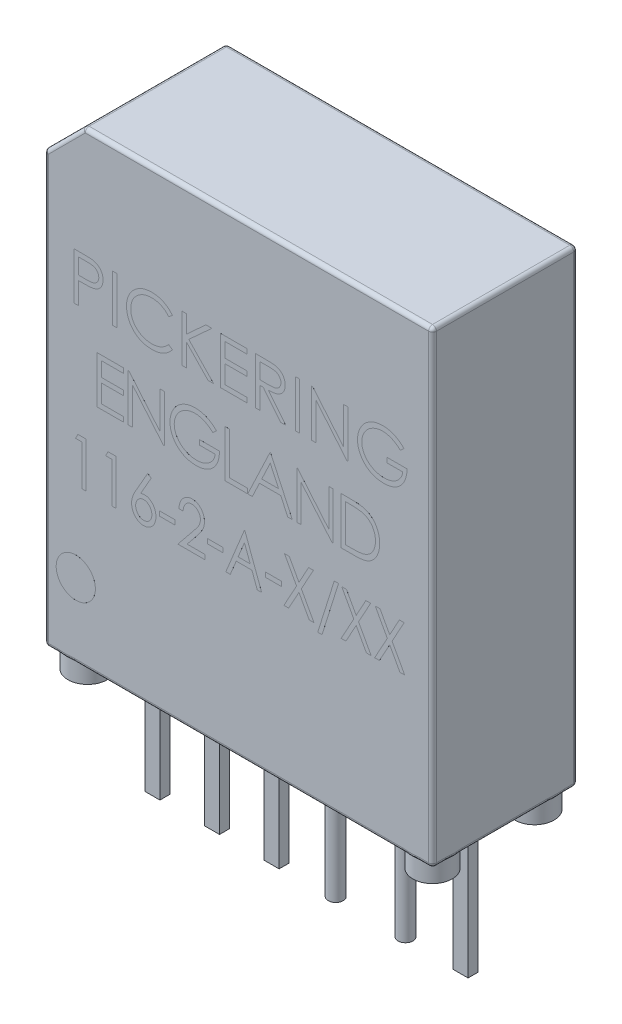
SolidWorks part; units mm, degrees
ref_plane "Front Plane" through (0, 0, 0) normal (0, 0, 1) x (1, 0, 0)
ref_plane "Top Plane" through (0, 0, 0) normal (0, 1, 0) x (1, 0, 0)
ref_plane "Right Plane" through (0, 0, 0) normal (1, 0, 0) x (0, 0, -1)
sketch "Sketch1" plane through (0, 0, 0) normal (0, 1, 0) x (1, 0, 0)
  line L1 (4.95, -1.85) -> (-4.95, -1.85)
  line L2 (4.95, -1.85) -> (4.95, 1.85)
  line L3 (4.95, 1.85) -> (-4.95, 1.85)
  line L4 (-4.95, -1.85) -> (-4.95, 1.85)
  line L5 (4.95, -1.85) -> (-4.95, 1.85) construction
  line L6 (4.95, 1.85) -> (-4.95, -1.85) construction
  point P0 (0, 0)
  dimension "D1" = 3.7
  dimension "D2" = 9.9
extrude "Main body" add sketch "Sketch1" along normal blind 11.942
sketch "Sketch2" plane through (0, 0, 1.85) normal (0, 0, 1) x (1, 0, 0)
  line L0 (-3.95, 11.942) -> (-4.95, 10.942)
  line L1 (-4.95, 11.942) -> (4.95, 11.942) construction
  line L2 (-4.95, 11.942) -> (-4.95, 0) construction
  line L3 (-4.95, 10.942) -> (-4.95, 11.942)
  line L4 (-4.95, 11.942) -> (-3.95, 11.942)
  dimension "D1" = 45
  dimension "D2" = 8.9
extrude "Box style cut" cut sketch "Sketch2" against normal through all
sketch "Sketch3" plane through (0, 0, 0) normal (0, -1, 0) x (1, 0, 0)
  line L0 (-4.95, 1.85) -> (4.95, 1.85) construction
  line L1 (-4.95, -1.85) -> (-4.95, 1.85) construction
  line L2 (4.95, -1.85) -> (-4.95, -1.85) construction
  line L3 (4.95, 1.85) -> (4.95, -1.85) construction
  circle A0 centre (-4.4, 1.3) radius 0.5
  circle A1 centre (-4.4, -1.3) radius 0.5
  circle A2 centre (4.4, -1.3) radius 0.5
  circle A3 centre (4.4, 1.3) radius 0.5
  dimension "D1" = 1
  dimension "D4" = 1
  dimension "D7" = 1
  dimension "D9" = 1
  dimension "D2" = 0.55
  dimension "D3" = 0.55
  dimension "D5" = 0.55
  dimension "D6" = 0.55
  dimension "D8" = 0.55
  dimension "D10" = 0.55
  dimension "D11" = 0.55
  dimension "D12" = 0.55
extrude "Feet" add sketch "Sketch3" along normal blind 0.508
sketch "Sketch4" plane through (0, 0, 0) normal (0, -1, 0) x (1, 0, 0)
  line L1 (-3.7395, -0.14) -> (-4.1205, -0.14)
  line L2 (-3.7395, -0.14) -> (-3.7395, 0.114)
  line L3 (-3.7395, 0.114) -> (-4.1205, 0.114)
  line L4 (-4.1205, -0.14) -> (-4.1205, 0.114)
  line L5 (-3.7395, -0.14) -> (-4.1205, 0.114) construction
  line L6 (-3.7395, 0.114) -> (-4.1205, -0.14) construction
  line L7 (-2.2195, -0.14) -> (-2.6005, -0.14)
  line L8 (-2.2195, -0.14) -> (-2.2195, 0.114)
  line L9 (-2.2195, 0.114) -> (-2.6005, 0.114)
  line L10 (-2.6005, -0.14) -> (-2.6005, 0.114)
  line L11 (-2.2195, -0.14) -> (-2.6005, 0.114) construction
  line L12 (-2.2195, 0.114) -> (-2.6005, -0.14) construction
  line L13 (-0.6995, -0.14) -> (-1.0805, -0.14)
  line L14 (-0.6995, -0.14) -> (-0.6995, 0.114)
  line L15 (-0.6995, 0.114) -> (-1.0805, 0.114)
  line L16 (-1.0805, -0.14) -> (-1.0805, 0.114)
  line L17 (-0.6995, -0.14) -> (-1.0805, 0.114) construction
  line L18 (-0.6995, 0.114) -> (-1.0805, -0.14) construction
  line L33 (4.1205, -0.14) -> (3.7395, -0.14)
  line L34 (4.1205, -0.14) -> (4.1205, 0.114)
  line L35 (4.1205, 0.114) -> (3.7395, 0.114)
  line L36 (3.7395, -0.14) -> (3.7395, 0.114)
  line L37 (4.1205, -0.14) -> (3.7395, 0.114) construction
  line L38 (4.1205, 0.114) -> (3.7395, -0.14) construction
  circle A0 centre (2.41, 0) radius 0.1905
  circle A1 centre (0.63, 0) radius 0.1905
  point P0 (-3.93, -0.013)
  point P5 (-2.41, -0.013)
  point P10 (-0.89, -0.013)
  point P27 (3.93, -0.013)
  dimension "D7" = 0.381
  dimension "D8" = 0.381
  dimension "D1" = 0.381
  dimension "D2" = 0.254
  dimension "D3" = 0.381
  dimension "D4" = 0.254
  dimension "D5" = 0.381
  dimension "D6" = 0.254
  dimension "D9" = 1.52
  dimension "D10" = 1.52
  dimension "D11" = 1.78
  dimension "D12" = 3.93
  dimension "D13" = 1.52
  dimension "D14" = 0.381
  dimension "D15" = 1.52
extrude "Pins" add sketch "Sketch4" along normal blind 3.678
sketch "Sketch5" plane through (0, 0, 1.85) normal (0, 0, 1) x (1, 0, 0)
  line L0 (-4.3474, 7.942) -> (4.2825, 7.942) construction
  line L1 (-3.95, 11.942) -> (4.95, 11.942) construction
  line L3 (-4.95, 10.942) -> (-4.95, 0) construction
  line L4 (-4.95, 0) -> (4.95, 0) construction
  line L5 (-4.3474, 5.942) -> (4.2825, 5.942) construction
  line L6 (-4.3474, 3.942) -> (4.2825, 3.942) construction
  circle A0 centre (-4.15, 1.9) radius 0.5
  text T0 "PICKERING" font "Century Gothic" height 1.2
  text T1 "ENGLAND" font "Century Gothic" height 1.2
  text T2 "116-2-A-X/XX" font "Century Gothic" height 1.15
  dimension "D5" = 1
  dimension "D1" = 4
  dimension "D2" = 2
  dimension "D3" = 2
  dimension "D6" = 1.9
  dimension "D7" = 0.8
extrude "Lettering" add sketch "Sketch5" along normal blind 0.0001
fillet "Fillet2" radius 0.1 15 edges at (4.95, 5.971, 1.85) (4.95, 11.942, 0) (4.95, 0, 0) (0, 0, -1.85) (4.95, 5.971, -1.85) (0.5, 11.942, -1.85) (-4.95, 0, 0) (-4.95, 5.471, -1.85) (-4.95, 5.471, 1.85) (-4.95, 10.942, 0) (-4.45, 11.442, -1.85) (-3.95, 11.942, 0) (-4.45, 11.442, 1.85) (0.5, 11.942, 1.85) (0, 0, 1.85)
